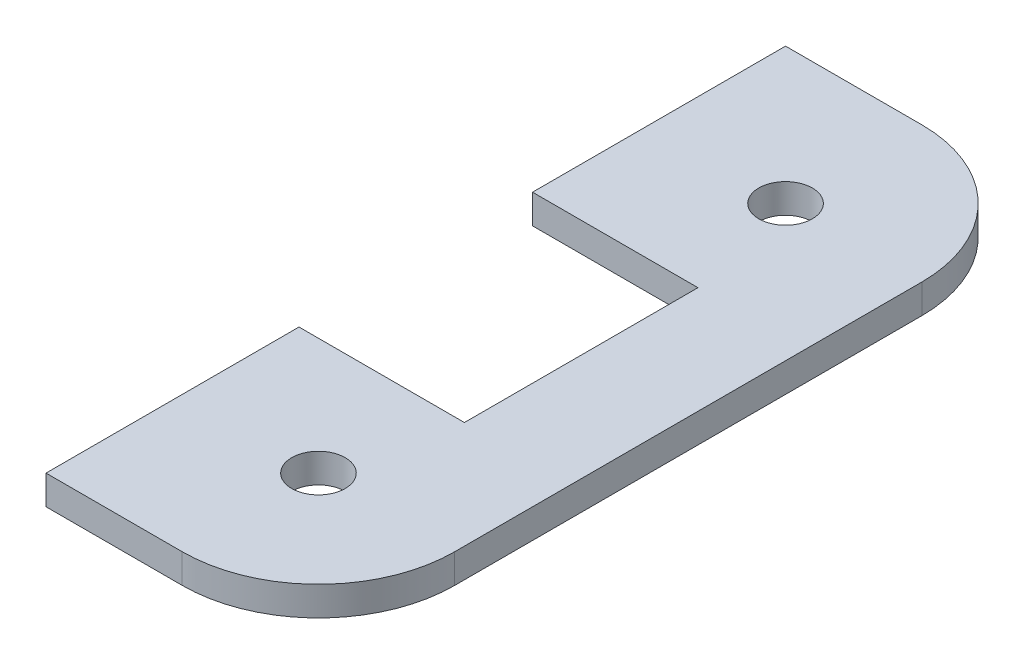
SolidWorks part; units mm, degrees
ref_plane "Front Plane" through (0, 0, 0) normal (0, 0, 1) x (1, 0, 0)
ref_plane "Top Plane" through (0, 0, 0) normal (0, 1, 0) x (1, 0, 0)
ref_plane "Right Plane" through (0, 0, 0) normal (1, 0, 0) x (0, 0, -1)
sketch "Sketch1" plane through (0, 0, 0) normal (0, 1, 0) x (1, 0, 0)
  line L4 (0, 0) -> (0, 26)
  line L6 (17, 50) -> (17, 26)
  line L9 (0, 26) -> (17, 26)
  line L10 (0, 50) -> (17, 50)
  line L11 (14, 76) -> (0, 76)
  line L12 (28, 14) -> (28, 62)
  line L13 (14, 0) -> (0, 0)
  line L14 (0, 50) -> (0, 76)
  circle A4 centre (14, 14) radius 2.75
  circle A5 centre (14, 62) radius 2.75
  arc A6 (14, 0) -> (28, 14) centre (14, 14) ccw
  arc A7 (28, 62) -> (14, 76) centre (14, 62) ccw
  dimension "D3" = 26
  dimension "D7" = 5.5
  dimension "D1" = 14
  dimension "D2" = 14
  dimension "D11" = 14
  dimension "D12" = 14
  dimension "D13" = 14
  dimension "D4" = 17
  dimension "D5" = 26
  dimension "D6" = 76
  dimension "D8" = 14
  dimension "D9" = 28
  dimension "D10" = 14
extrude "Extrude1" add sketch "Sketch1" along normal blind 3
